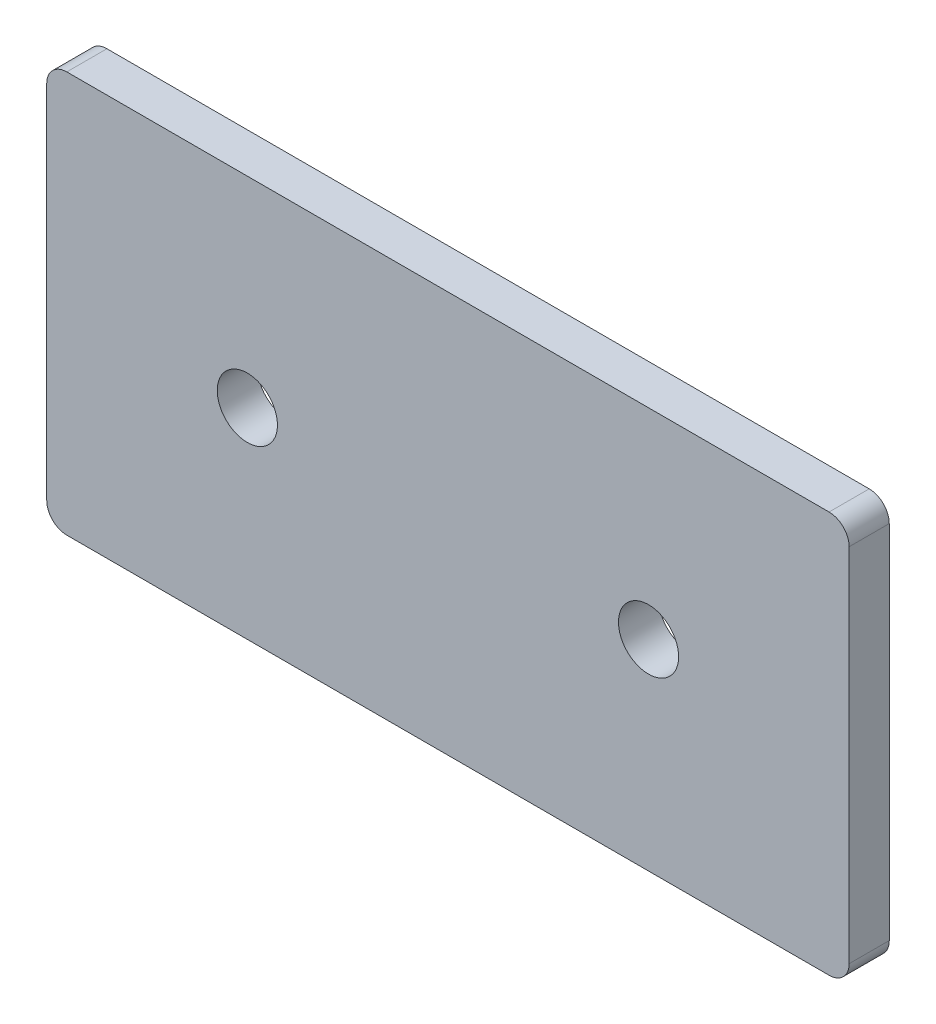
SolidWorks part; units mm, degrees
ref_plane "Plan1" through (0, 0, 0) normal (0, 0, 1) x (1, 0, 0)
ref_plane "Plan2" through (0, 0, 0) normal (0, 1, 0) x (1, 0, 0)
ref_plane "Plan3" through (0, 0, 0) normal (1, 0, 0) x (0, 0, -1)
sketch "Esquisse1" plane through (0, 0, 0) normal (0, 0, 1) x (1, 0, 0)
  line L1 (2, 0) -> (78, 0)
  line L2 (0, 2) -> (0, 38)
  line L3 (2, 40) -> (78, 40)
  line L4 (80, 2) -> (80, 38)
  arc A0 (78, 40) -> (80, 38) centre (78, 38) cw
  arc A1 (0, 38) -> (2, 40) centre (2, 38) cw
  arc A2 (2, 0) -> (0, 2) centre (2, 2) cw
  arc A3 (80, 2) -> (78, 0) centre (78, 2) cw
  point P9 (0, 40)
  point P12 (0, 0)
  point P15 (80, 0)
  dimension "D3" = 2
  dimension "D1" = 80
  dimension "D2" = 40
extrude "Base-Extrusion" add sketch "Esquisse1" along normal blind 4
sketch "Esquisse2" plane through (0, 0, 4) normal (0, 0, 1) x (1, 0, 0)
  line L0 (0, 38) -> (0, 2) construction
  line L1 (2, 0) -> (78, 0) construction
  circle A0 centre (60, 20) radius 3
  circle A1 centre (20, 20) radius 3
  dimension "D1" = 6
  dimension "D2" = 6
  dimension "D3" = 40
  dimension "D4" = 20
  dimension "D5" = 20
extrude "Enlèv. mat.-Extru.1" cut sketch "Esquisse2" against normal through all
